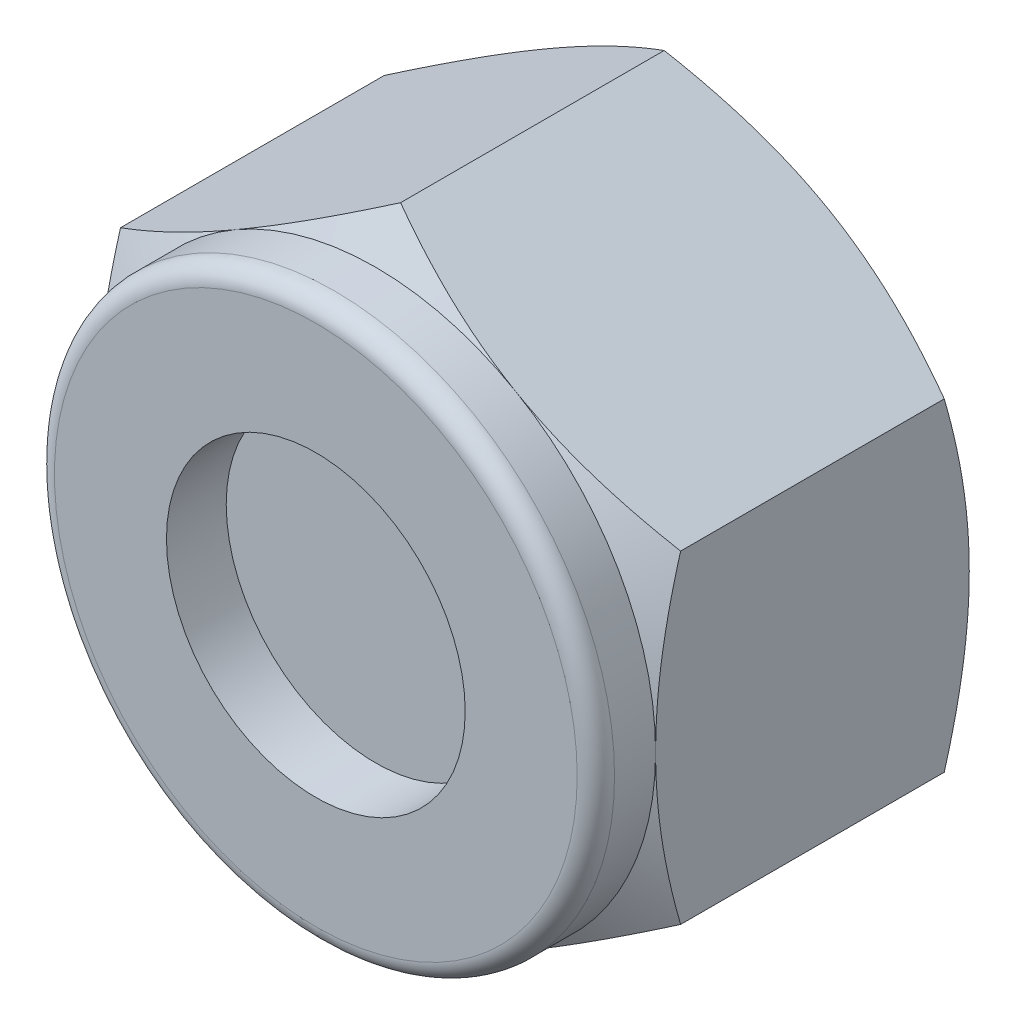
SolidWorks part; units mm, degrees
ref_plane "Plan1" through (0, 0, 0) normal (0, 0, 1) x (1, 0, 0)
ref_plane "Plan2" through (0, 0, 0) normal (0, 1, 0) x (1, 0, 0)
ref_plane "Plan3" through (0, 0, 0) normal (1, 0, 0) x (0, 0, -1)
sketch "Esquisse1" plane through (0, 0, 0) normal (0, 0, 1) x (1, 0, 0)
  circle A1 centre (0, 0) radius 7.5
  circle A2 centre (0, 0) radius 4
  circle A3 centre (0, 0) radius 4
  dimension "D2" = 15
  dimension "D1" = 1
extrude "Base-Extrusion" add sketch "Esquisse1" along normal blind 10
sketch "Esquisse2" plane through (0, 0, 0) normal (0, 0, 1) x (1, 0, 0)
  line L0 (7.5, 4.3301) -> (7.5, -4.3301)
  line L1 (7.5, 4.3301) -> (0, 8.6603)
  line L2 (12, 0) -> (-17, 0) construction
  line L3 (0, 12) -> (0, -11) construction
  line L4 (-7.5, 4.3301) -> (-7.5, -4.3301)
  line L5 (-7.5, 4.3301) -> (0, 8.6603)
  line L6 (-7.5, -4.3301) -> (0, -8.6603)
  line L7 (7.5, -4.3301) -> (0, -8.6603)
  circle A1 centre (0, 0) radius 7.5 construction
  circle A2 centre (0, 0) radius 11 construction
  point P15 (-7.5, 0)
  point P17 (7.5, 0)
  dimension "D1" = 120
extrude "Boss.-Extru.1" add sketch "Esquisse2" along normal blind 8.4
sketch "Esquisse4" plane through (0, 0, 0) normal (0, 1, 0) x (1, 0, 0)
  line L0 (7.5, 0) -> (15, 0)
  line L1 (7.5, -8.4) -> (15, -8.4)
  line L2 (7.5, 0) -> (13, -3.1754)
  line L3 (13, -3.1754) -> (13, -5.2246)
  line L4 (13, -5.2246) -> (7.5, -8.4)
  line L5 (15, -8.4) -> (15, 0)
  line L6 (0, 17) -> (0, -21) construction
  line L7 (0, 4) -> (0, 512) construction
  dimension "D1" = 30
  dimension "D2" = 30
revolve "Enlèvement de matière-Révolution2" cut sketch "Esquisse4" angle 360 about L6
fillet "Congé1" radius 0.5
